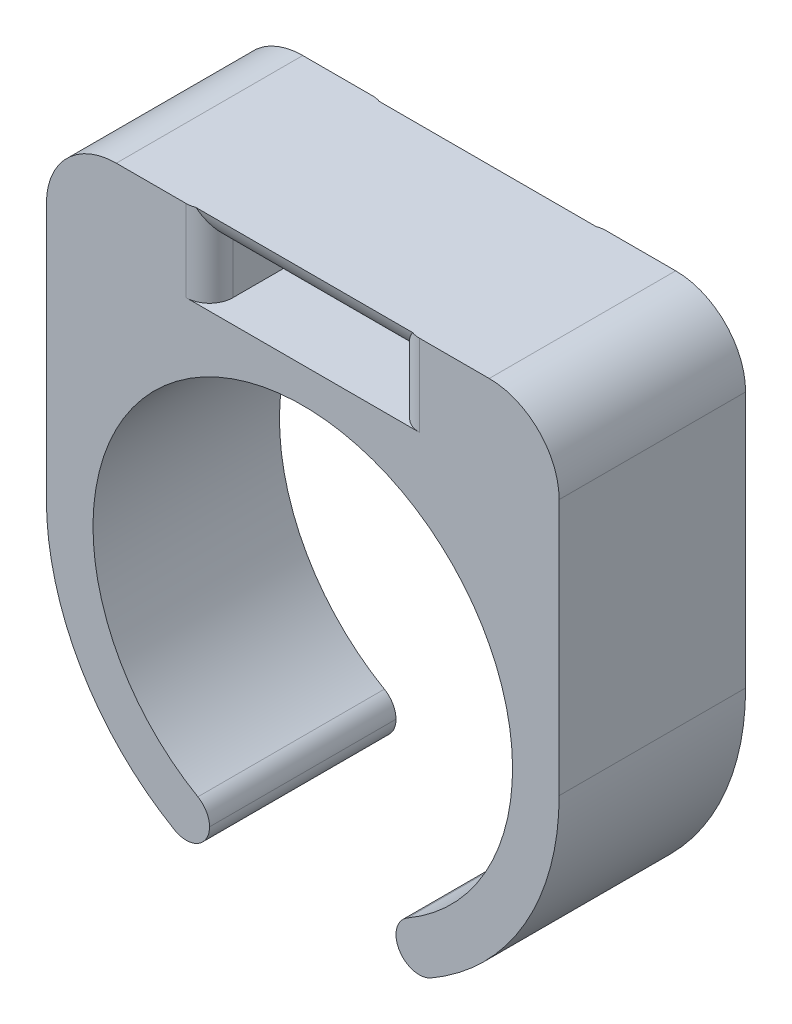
SolidWorks part; units mm, degrees
ref_plane "Plan de face" through (0, 0, 0) normal (0, 0, 1) x (1, 0, 0)
ref_plane "Plan de dessus" through (0, 0, 0) normal (0, 1, 0) x (1, 0, 0)
ref_plane "Plan de droite" through (0, 0, 0) normal (1, 0, 0) x (0, 0, -1)
sketch "Esquisse1" plane through (0, 0, 0) normal (0, 0, 1) x (1, 0, 0)
  circle A0 centre (0, 0) radius 11
  circle A1 centre (0, 0) radius 9
  dimension "D1" = 22
  dimension "D2" = 18
extrude "Boss.-Extru.1" add sketch "Esquisse1" along normal blind 8
sketch "Esquisse2" plane through (0, 0, 8) normal (0, 0, 1) x (1, 0, 0)
  line L0 (-11, 0) -> (-11, 14)
  line L1 (-11, 14) -> (11, 14)
  line L2 (11, 0) -> (11, 14)
  line L3 (-11, 0) -> (-9, 0)
  line L4 (11, 0) -> (9, 0)
  circle A0 centre (0, 0) radius 11 construction
  circle A5 centre (0, 0) radius 9 construction
  arc A6 (9, 0) -> (-9, 0) centre (0, 0) ccw
  dimension "D1" = 14
extrude "Boss.-Extru.2" add sketch "Esquisse2" against normal blind 8 contours L1 L2 L4 A6 L3 L0
sketch "Esquisse3" plane through (0, 0, 8) normal (0, 0, 1) x (1, 0, 0)
  line L1 (-4, 12.5) -> (4, 12.5)
  line L2 (-4, 12.5) -> (-4, 10.5)
  line L3 (-4, 10.5) -> (4, 10.5)
  line L4 (4, 12.5) -> (4, 10.5)
  line L6 (-11, 14) -> (11, 14) construction
  point P4 (0, 12.5)
  point P5 (0, 14)
  dimension "D1" = 8
  dimension "D2" = 2
  dimension "D4" = 1.5
fillet "Congé1" radius 3 2 edges at (11, 14, 4) (-11, 14, 4)
extrude "Enlèv. mat.-Extru.1" cut sketch "Esquisse3" against normal blind 8
sketch "Esquisse4" plane through (0, 0, 8) normal (0, 0, 1) x (1, 0, 0)
  line L1 (-4, -4.7723) -> (4, -4.7723)
  line L2 (-4, -4.7723) -> (-4, -15.6912)
  line L3 (-4, -15.6912) -> (4, -15.6912)
  line L4 (4, -4.7723) -> (4, -15.6912)
  dimension "D1" = 8
  dimension "D2" = 4
extrude "Enlèv. mat.-Extru.2" cut sketch "Esquisse4" against normal blind 10
fillet "Congé4" radius 1 4 edges at (4, -10.247, 4) (4, -8.0623, 4) (-4, -10.247, 4) (-4, -8.0623, 4)
fillet "Congé5" radius 2 2 edges at (0, 12.5, 0) (0, 12.5, 8)
fillet "Congé6" radius 1 4 edges at (-4, 12.25, 0) (4, 12.25, 0) (4, 12.25, 8) (-4, 12.25, 8)
